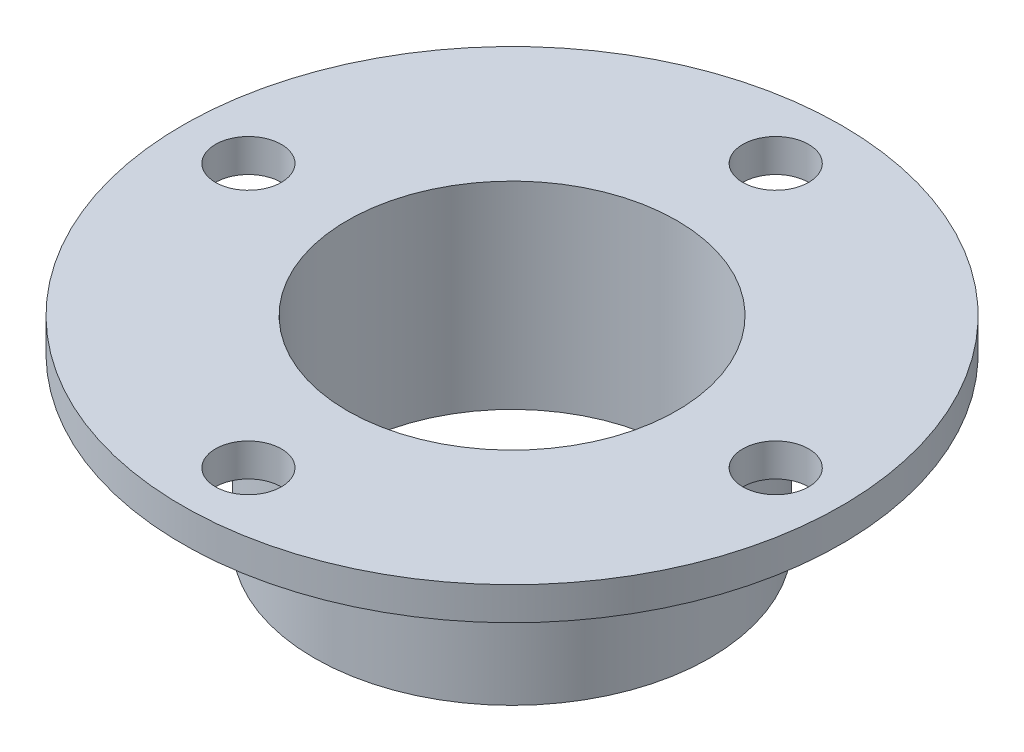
SolidWorks part; units mm, degrees
ref_plane "Front Plane" through (0, 0, 0) normal (0, 0, 1) x (1, 0, 0)
ref_plane "Top Plane" through (0, 0, 0) normal (0, 1, 0) x (1, 0, 0)
ref_plane "Right Plane" through (0, 0, 0) normal (1, 0, 0) x (0, 0, -1)
sketch "Sketch1" plane through (0, 0, 0) normal (0, 0, 1) x (1, 0, 0)
  line L0 (0, 0) -> (0, 38.1)
  line L1 (0, 38.1) -> (63.5, 38.1)
  line L2 (63.5, 38.1) -> (63.5, 31.75)
  line L3 (63.5, 31.75) -> (38.1, 31.75)
  line L4 (38.1, 31.75) -> (38.1, 0)
  line L5 (38.1, 0) -> (0, 0)
  dimension "D1" = 38.1
  dimension "D2" = 63.5
  dimension "D3" = 6.35
  dimension "D4" = 38.1
revolve "Revolve1" add sketch "Sketch1" angle 360 about L0
sketch "Sketch2" plane through (0, 0, 0) normal (0, -1, 0) x (1, 0, 0)
  circle A0 centre (0, 0) radius 31.75
  circle A1 centre (0, 0) radius 38.1 construction
  dimension "D1" = 6.35
extrude "Cut-Extrude1" cut sketch "Sketch2" against normal through all
sketch "Sketch3" plane through (0, 38.1, 0) normal (0, 1, 0) x (1, 0, 0)
  line L0 (0, 0) -> (0, 31.75) construction
  line L1 (0, 63.5) -> (0, 38.1) construction
  circle A0 centre (0, 0) radius 31.75 construction
  circle A2 centre (0, 50.8) radius 6.35
  circle A3 centre (0, 0) radius 63.5 construction
  circle A4 centre (0, 0) radius 38.1 construction
  dimension "D1" = 12.7
extrude "Cut-Extrude2" cut sketch "Sketch3" against normal through all
pattern_circular "CirPattern1" count 4 over 360 about axis through (0, 0, 0) along (0, 1, 0) of "Cut-Extrude2"
